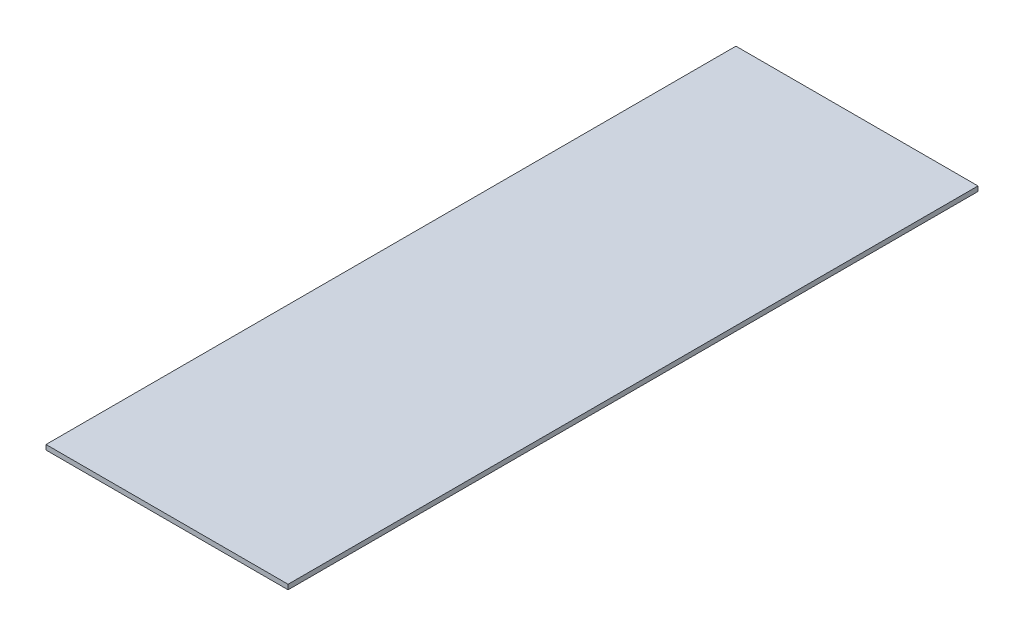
SolidWorks part; units mm, degrees
ref_plane "Front Plane" through (0, 0, 0) normal (0, 0, 1) x (1, 0, 0)
ref_plane "Top Plane" through (0, 0, 0) normal (0, 1, 0) x (1, 0, 0)
ref_plane "Right Plane" through (0, 0, 0) normal (1, 0, 0) x (0, 0, -1)
sketch "Sketch2" plane through (0, 0, 0) normal (0, 1, 0) x (1, 0, 0)
  line L1 (-63.5, -180.975) -> (63.5, -180.975)
  line L2 (-63.5, -180.975) -> (-63.5, 180.975)
  line L3 (-63.5, 180.975) -> (63.5, 180.975)
  line L4 (63.5, -180.975) -> (63.5, 180.975)
  line L5 (-63.5, -180.975) -> (63.5, 180.975) construction
  line L6 (-63.5, 180.975) -> (63.5, -180.975) construction
  point P0 (0, 0)
  dimension "D1" = 361.95
  dimension "D2" = 127
extrude "Boss-Extrude1" add sketch "Sketch2" along normal blind 2.54
